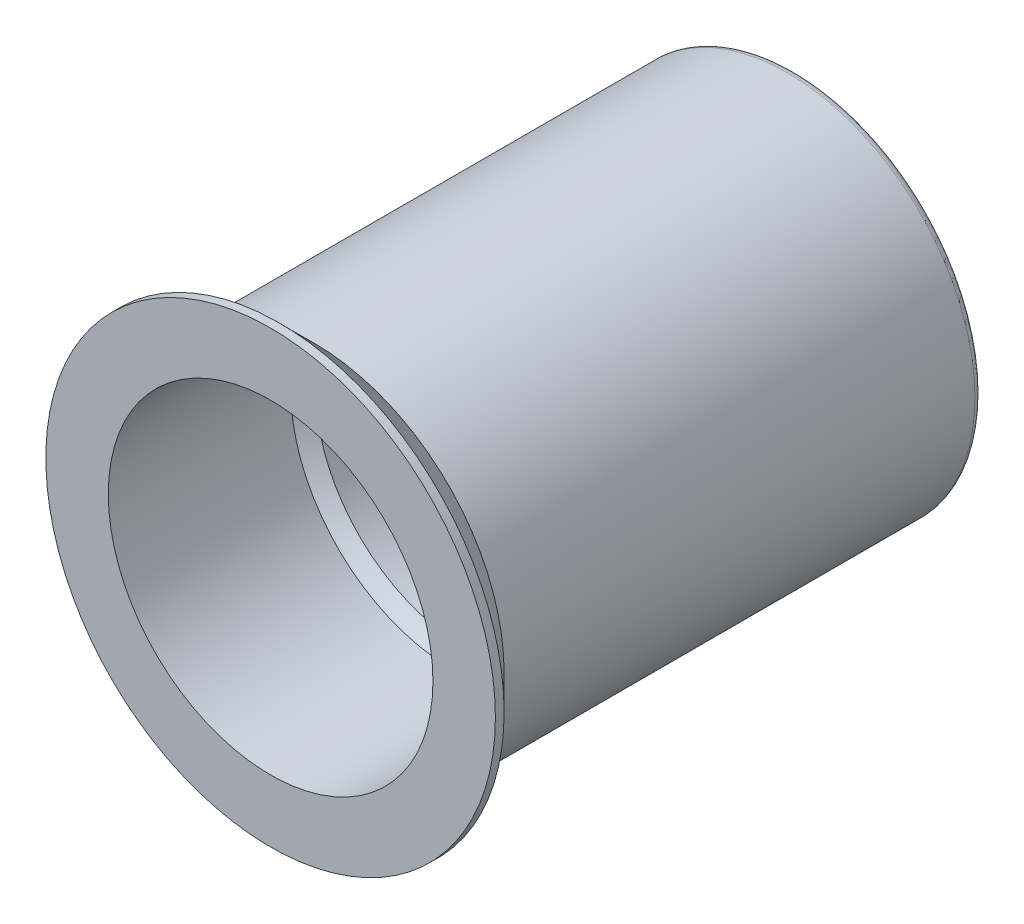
SolidWorks part; units mm, degrees
ref_plane "Front" through (0, 0, 0) normal (0, 0, 1) x (1, 0, 0)
ref_plane "Top" through (0, 0, 0) normal (0, 1, 0) x (1, 0, 0)
ref_plane "Right" through (0, 0, 0) normal (1, 0, 0) x (0, 0, -1)
sketch "Sketch3" plane through (0, 0, 0) normal (0, 0, 1) x (1, 0, 0)
  circle A0 centre (0, 0) radius 9
  dimension "dk" = 18
extrude "BaseHead" add sketch "Sketch3" against normal blind 1.8
sketch "Sketch4" plane through (-3.067, 2.6488, 0) normal (0, 0, -1) x (-1, 0, 0)
  circle A0 centre (-3.067, -2.6488) radius 7.5
  circle A1 centre (-3.067, -2.6488) radius 9 construction
  dimension "d" = 15
extrude "BaseBody" add sketch "Sketch4" along normal blind 21
sketch "Sketch8" plane through (9, 0, 1.1855) normal (0, 1, 0) x (-1, 0, 0)
  line L0 (9, 2.3542) -> (9, -3.5397) construction
  line L2 (18, -1.5355) -> (16.55, -2.9855)
  line L5 (16.55, -2.9855) -> (18, -2.9855)
  line L7 (18, -2.9855) -> (18, -1.5355)
  dimension "D1" = 45
  dimension "D2" = 15.1
revolve "BearingFace" cut sketch "Sketch8" angle 360 about L0
sketch "Sketch5" plane through (1.6426, -1.4193, 0) normal (0, 0, 1) x (1, 0, 0)
  circle A0 centre (-1.6426, 1.4193) radius 6.5
  circle A1 centre (-1.6426, 1.4193) radius 9 construction
  dimension "d1" = 13
extrude "Hole1" cut sketch "Sketch5" against normal blind 7.3
sketch "Sketch6" plane through (-0.0097, -0.1511, -7.3) normal (0, 0, 1) x (1, 0, 0)
  circle A0 centre (0.0097, 0.1511) radius 6
  circle A1 centre (0.0097, 0.1511) radius 6.5 construction
  dimension "D1" = 12
extrude "Hole2" cut sketch "Sketch6" against normal through all
fillet "Fillet1" radius 0.3 2 edges at (-7.5, 0, -21) (7.55, 0, -1.8)
chamfer "Chamfer1" distance 0.5 angle 45 1 edges at (6, 0, -7.3)
chamfer "Chamfer2" distance 0.48 angle 45 1 edges at (6, 0, -21)
sketch "Sketch9" plane through (0, 0, 0) normal (0, 1, 0) x (1, 0, 0)
  line L0 (0, 25.6256) -> (0, 13.1025) construction
  line L1 (5.5, 20.77) -> (6, 20.77)
  line L2 (6, 20.77) -> (6.433, 20.52)
  line L3 (6.433, 20.52) -> (6, 20.27)
  line L4 (6, 20.27) -> (5.5, 20.27)
  line L5 (5.5, 20.27) -> (5.5, 20.77)
  line L6 (-6, 20.52) -> (6, 20.52) construction
  dimension "D1" = 0.5
  dimension "D2" = 12
revolve "Cut-Revolve10" [suppressed] cut sketch "Sketch9" angle 360 about L0
pattern_linear "LPattern10" [suppressed] count 22 spacing 0.6 along (0, 0, 1)
equation "\"D2@Sketch8\"=\"d@Sketch4\"+ 0.1"
equation "\"D1@Chamfer1\" =  ( \"d1@Sketch5\" - \"D1@Sketch6\" )  / 2"
equation "\"D1@Chamfer2\" = \"D1@Sketch6\" / 25"
equation "\"D1@Sketch9\" = (  \"D2@ThreadCosmetic1\" - \"D1@Sketch6\" )  / 2"
equation "\"D3@LPattern10\" = \"D1@Sketch9\" * 1.2"
equation "\"D1@LPattern10\" = (  \"l@BaseBody\" - \"l1@Hole1\" )  / \"D3@LPattern10\" - 1"
equation "\"D2@Sketch9\" = \"D1@Sketch6\""
